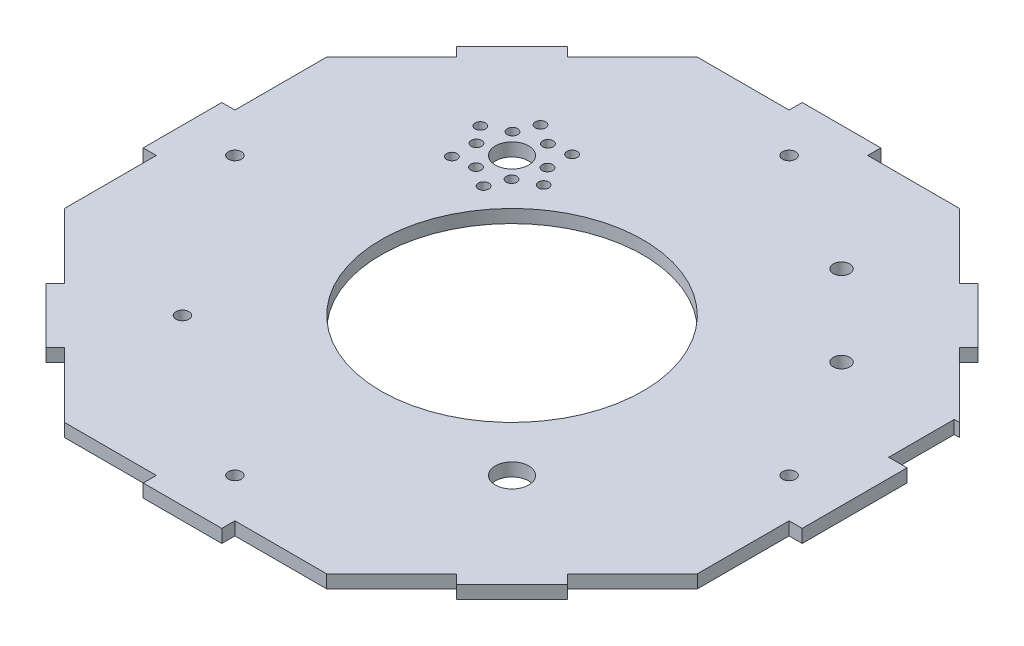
SolidWorks part; units mm, degrees
ref_plane "Alzado" through (0, 0, 0) normal (0, 0, 1) x (1, 0, 0)
ref_plane "Planta" through (0, 0, 0) normal (0, 1, 0) x (1, 0, 0)
ref_plane "Vista lateral" through (0, 0, 0) normal (1, 0, 0) x (0, 0, -1)
sketch "Croquis1" plane through (0, 0, 0) normal (0, 1, 0) x (1, 0, 0)
  line L0 (-30.909, -85.6617) -> (-30.909, -50.6617)
  line L1 (-30.909, 14.3383) -> (-6.1602, 39.087)
  line L2 (39.8017, 85.049) -> (74.8017, 85.049)
  line L3 (139.8017, 85.049) -> (164.5504, 60.3002)
  line L5 (210.5124, -85.6617) -> (185.7636, -110.4105)
  line L6 (139.8017, -156.3724) -> (104.8017, -156.3724)
  line L7 (39.8017, -156.3724) -> (15.053, -131.6237)
  line L8 (210.5124, -10.6617) -> (208.5124, -10.6617)
  line L9 (208.5124, -10.6617) -> (208.5124, 14.3383)
  line L10 (208.5124, 14.3383) -> (210.5124, 14.3383)
  line L16 (-35.909, -50.6617) -> (-35.909, -20.6617)
  line L21 (-9.6958, 42.6225) -> (11.5174, 63.8358)
  line L22 (74.8017, 90.049) -> (104.8017, 90.049)
  line L23 (168.086, 63.8358) -> (189.2992, 42.6225)
  line L24 (189.2992, -113.946) -> (168.086, -135.1592)
  line L25 (104.8017, -161.3724) -> (74.8017, -161.3724)
  line L26 (11.5174, -135.1592) -> (-9.6958, -113.946)
  line L27 (215.5124, -10.6617) -> (215.5124, -50.6617)
  line L28 (15.053, 60.3002) -> (39.8017, 85.049)
  line L30 (-35.909, 16.4093) -> (37.7306, 90.049) construction
  line L31 (37.7306, 90.049) -> (141.8728, 90.049) construction
  line L32 (-30.909, -20.6617) -> (-30.909, 14.3383)
  line L33 (164.5504, -131.6237) -> (139.8017, -156.3724)
  line L34 (-30.909, 14.3383) -> (39.8017, 85.049) construction
  line L36 (-35.909, -85.6617) -> (-35.909, 16.4093) construction
  line L37 (104.8017, 85.049) -> (139.8017, 85.049)
  line L38 (189.2992, -113.946) -> (185.7636, -110.4105)
  line L39 (-9.6958, 42.6225) -> (-6.1602, 39.087)
  line L40 (210.5124, -50.6617) -> (210.5124, -85.6617)
  line L41 (168.086, 63.8358) -> (164.5504, 60.3002)
  line L42 (-35.909, -50.6617) -> (-30.909, -50.6617)
  line L43 (189.2992, 42.6225) -> (185.7636, 39.087)
  line L44 (-35.909, -20.6617) -> (-30.909, -20.6617)
  line L45 (-30.909, -85.6617) -> (-30.909, 14.3383) construction
  line L46 (185.7636, 39.087) -> (210.5124, 14.3383)
  line L47 (39.8017, 85.049) -> (139.8017, 85.049) construction
  line L48 (141.8728, 90.049) -> (214.0479, 17.8738) construction
  line L50 (-6.1602, -110.4105) -> (-30.909, -85.6617)
  line L51 (15.053, 60.3002) -> (11.5174, 63.8358)
  line L52 (139.8017, 85.049) -> (210.5124, 14.3383) construction
  line L56 (214.0479, -89.1973) -> (141.8728, -161.3724) construction
  line L57 (210.5124, -85.6617) -> (139.8017, -156.3724) construction
  line L58 (37.7306, -161.3724) -> (-34.4445, -89.1973) construction
  line L59 (74.8017, -156.3724) -> (39.8017, -156.3724)
  line L60 (-6.1602, -110.4105) -> (-9.6958, -113.946)
  line L62 (15.053, -131.6237) -> (11.5174, -135.1592)
  line L63 (164.5504, -131.6237) -> (168.086, -135.1592)
  line L64 (39.8017, -156.3724) -> (-30.909, -85.6617) construction
  line L65 (141.8728, -161.3724) -> (37.7306, -161.3724) construction
  line L67 (210.5124, -50.6617) -> (215.5124, -50.6617)
  line L68 (139.8017, -156.3724) -> (39.8017, -156.3724) construction
  line L69 (210.5124, -10.6617) -> (215.5124, -10.6617)
  line L73 (74.8017, -161.3724) -> (74.8017, -156.3724)
  line L74 (104.8017, 90.049) -> (104.8017, 85.049)
  line L77 (74.8017, 85.049) -> (74.8017, 90.049)
  line L79 (104.8017, -156.3724) -> (104.8017, -161.3724)
  circle A0 centre (89.8017, -35.6617) radius 50
  circle A1 centre (89.8017, -141.3724) radius 2.5
  circle A2 centre (89.8017, 70.049) radius 2.5
  circle A3 centre (-15.909, -35.6617) radius 2.5
  circle A4 centre (195.5124, -35.6617) radius 2.5
  circle A5 centre (26.9464, -98.5171) radius 2.5
  circle A6 centre (137.2281, 42.6225) radius 3.175
  circle A7 centre (36.9464, 17.1936) radius 6.35
  circle A8 centre (142.657, -88.5171) radius 6.35
  circle A9 centre (168.086, 11.7647) radius 3.175
  point P29 (215.5124, 14.3383)
  point P30 (215.5124, -85.6617)
  point P37 (210.5124, -20.6617)
  point P43 (185.7636, -110.4105)
  dimension "D5" = 100
  dimension "D14" = 6.35
  dimension "D15" = 5
  dimension "D16" = 5
  dimension "D17" = 5
  dimension "D18" = 5
  dimension "D19" = 5
  dimension "D26" = 12.7
  dimension "D1" = 135
  dimension "D2" = 135
  dimension "D3" = 135
  dimension "D6" = 135
  dimension "D7" = 135
  dimension "D8" = 100
  dimension "D9" = 100
  dimension "D10" = 100
  dimension "D11" = 100
  dimension "D12" = 5
  dimension "D13" = 100
  dimension "D22" = 20
  dimension "D23" = 20
  dimension "D24" = 20
  dimension "D25" = 20
  dimension "D27" = 2
  dimension "D28" = 25
  dimension "D20" = 5
extrude "Saliente-Extruir1" add sketch "Croquis1" along normal blind 5
sketch "Croquis2" plane through (0, 5, 0) normal (0, 1, 0) x (1, 0, 0)
  circle A0 centre (47.7254, 19.9553) radius 2
  circle A1 centre (36.9464, 17.1936) radius 6.35
  circle A2 centre (44.7275, 9.2395) radius 2
  circle A3 centre (33.9485, 6.4779) radius 2
  circle A4 centre (26.1673, 14.4319) radius 2
  circle A5 centre (29.1652, 25.1477) radius 2
  circle A6 centre (39.9442, 27.9094) radius 2
  circle A7 centre (52.7352, 13.4782) radius 2
  circle A8 centre (36.9464, 17.1936) radius 6.35
  circle A9 centre (48.0584, 29.0094) radius 2
  circle A10 centre (36.9464, 17.1936) radius 6.35
  circle A11 centre (32.2696, 32.7249) radius 2
  circle A12 centre (36.9464, 17.1936) radius 6.35
  circle A13 centre (21.1575, 20.909) radius 2
  circle A14 centre (36.9464, 17.1936) radius 6.35
  circle A15 centre (25.8343, 5.3778) radius 2
  circle A16 centre (36.9464, 17.1936) radius 6.35
  circle A17 centre (41.6231, 1.6624) radius 2
  point P17 (36.9464, 17.1936)
  point P35 (36.9464, 17.1936)
  dimension "D1" = 6
  dimension "D2" = 4
  dimension "D3" = 6
extrude "Cortar-Extruir1" cut sketch "Croquis2" against normal blind 10 contours A5 | A6 | A9 | A0 | A7 | A2 | A17 | A3 | A15 | A4 | A13 | A11
